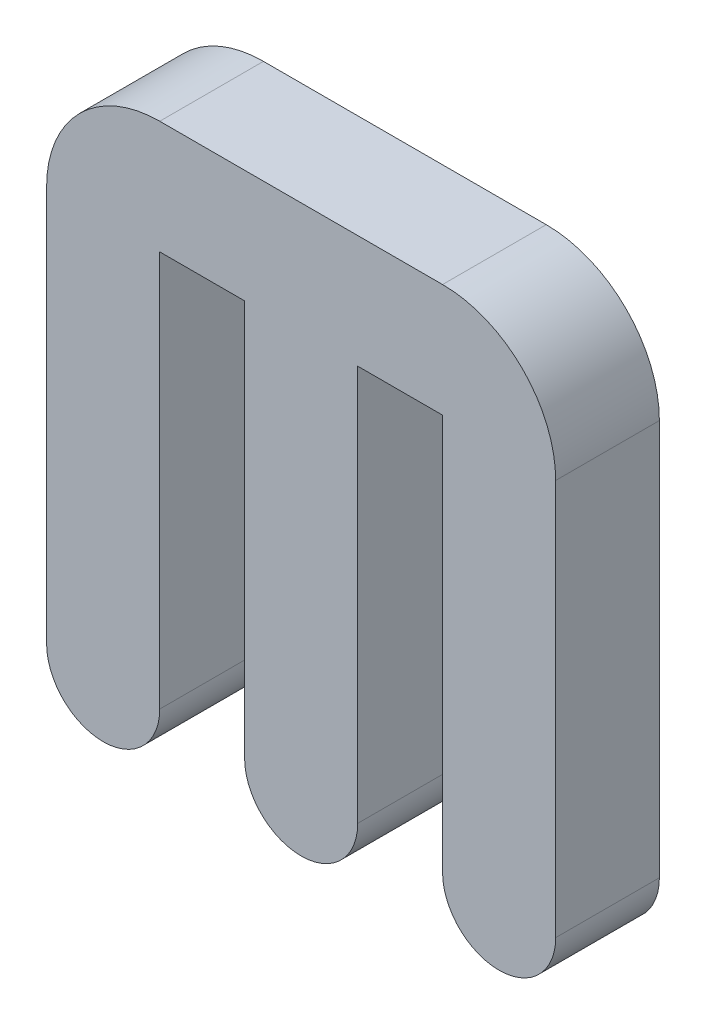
SolidWorks part; units mm, degrees
ref_plane "Front Plane" through (0, 0, 0) normal (0, 0, 1) x (1, 0, 0)
ref_plane "Top Plane" through (0, 0, 0) normal (0, 1, 0) x (1, 0, 0)
ref_plane "Right Plane" through (0, 0, 0) normal (1, 0, 0) x (0, 0, -1)
sketch "Sketch1" plane through (0, 0, 0) normal (0, 0, 1) x (1, 0, 0)
  line L0 (1.6364, 5) -> (4.0909, 5)
  line L1 (4.0909, 5) -> (4.0909, -6.4545)
  line L2 (7.3636, -6.4545) -> (7.3636, 5)
  line L3 (4.0909, 8.2727) -> (-4.0909, 8.2727)
  line L4 (-7.3636, 5) -> (-7.3636, -6.4545)
  line L5 (-4.0909, -6.4545) -> (-4.0909, 5)
  line L6 (-4.0909, 5) -> (-1.6364, 5)
  line L7 (-1.6364, 5) -> (-1.6364, -6.4545)
  line L8 (1.6364, -6.4545) -> (1.6364, 5)
  circle A1 centre (0, 0) radius 12.35
  circle A2 centre (0, 0) radius 14.35
  arc A3 (4.0909, -6.4545) -> (7.3636, -6.4545) centre (5.7273, -6.4545) ccw
  arc A4 (7.3636, 5) -> (4.0909, 8.2727) centre (4.0909, 5) ccw
  arc A5 (-4.0909, 8.2727) -> (-7.3636, 5) centre (-4.0909, 5) ccw
  arc A6 (-7.3636, -6.4545) -> (-4.0909, -6.4545) centre (-5.7273, -6.4545) ccw
  arc A7 (-1.6364, -6.4545) -> (1.6364, -6.4545) centre (0, -6.4545) ccw
sketch "Sketch2" plane through (0, 0, 0) normal (0, 0, 1) x (1, 0, 0)
  line L0 (4.0909, 8.2727) -> (-4.0909, 8.2727) construction
  line L1 (7.3636, -6.4545) -> (7.3636, 5) construction
  line L2 (4.0909, 5) -> (4.0909, -6.4545) construction
  line L3 (1.6364, 5) -> (4.0909, 5) construction
  line L4 (1.6364, -6.4545) -> (1.6364, 5) construction
  line L5 (-4.0909, 5) -> (-1.6364, 5) construction
  line L6 (-1.6364, 5) -> (-1.6364, -6.4545) construction
  line L7 (-4.0909, -6.4545) -> (-4.0909, 5) construction
  line L8 (-7.3636, 5) -> (-7.3636, -6.4545) construction
  line L9 (4.0909, 8.2727) -> (-4.0909, 8.2727)
  line L10 (7.3636, -6.4545) -> (7.3636, 5)
  line L11 (4.0909, 5) -> (4.0909, -6.4545)
  line L12 (1.6364, 5) -> (4.0909, 5)
  line L13 (1.6364, -6.4545) -> (1.6364, 5)
  line L14 (-4.0909, 5) -> (-1.6364, 5)
  line L15 (-1.6364, 5) -> (-1.6364, -6.4545)
  line L16 (-4.0909, -6.4545) -> (-4.0909, 5)
  line L17 (-7.3636, 5) -> (-7.3636, -6.4545)
  arc A1 (-4.0909, 8.2727) -> (-7.3636, 5) centre (-4.0909, 5) ccw construction
  arc A2 (7.3636, 5) -> (4.0909, 8.2727) centre (4.0909, 5) ccw construction
  arc A3 (-7.3636, -6.4545) -> (-4.0909, -6.4545) centre (-5.7273, -6.4545) ccw construction
  arc A4 (-1.6364, -6.4545) -> (1.6364, -6.4545) centre (0, -6.4545) ccw construction
  arc A5 (4.0909, -6.4545) -> (7.3636, -6.4545) centre (5.7273, -6.4545) ccw construction
  arc A6 (-4.0909, 8.2727) -> (-7.3636, 5) centre (-4.0909, 5) ccw
  arc A7 (7.3636, 5) -> (4.0909, 8.2727) centre (4.0909, 5) ccw
  arc A8 (-7.3636, -6.4545) -> (-4.0909, -6.4545) centre (-5.7273, -6.4545) ccw
  arc A9 (-1.6364, -6.4545) -> (1.6364, -6.4545) centre (0, -6.4545) ccw
  arc A10 (4.0909, -6.4545) -> (7.3636, -6.4545) centre (5.7273, -6.4545) ccw
extrude "Boss-Extrude4" add sketch "Sketch2" along normal blind 3
